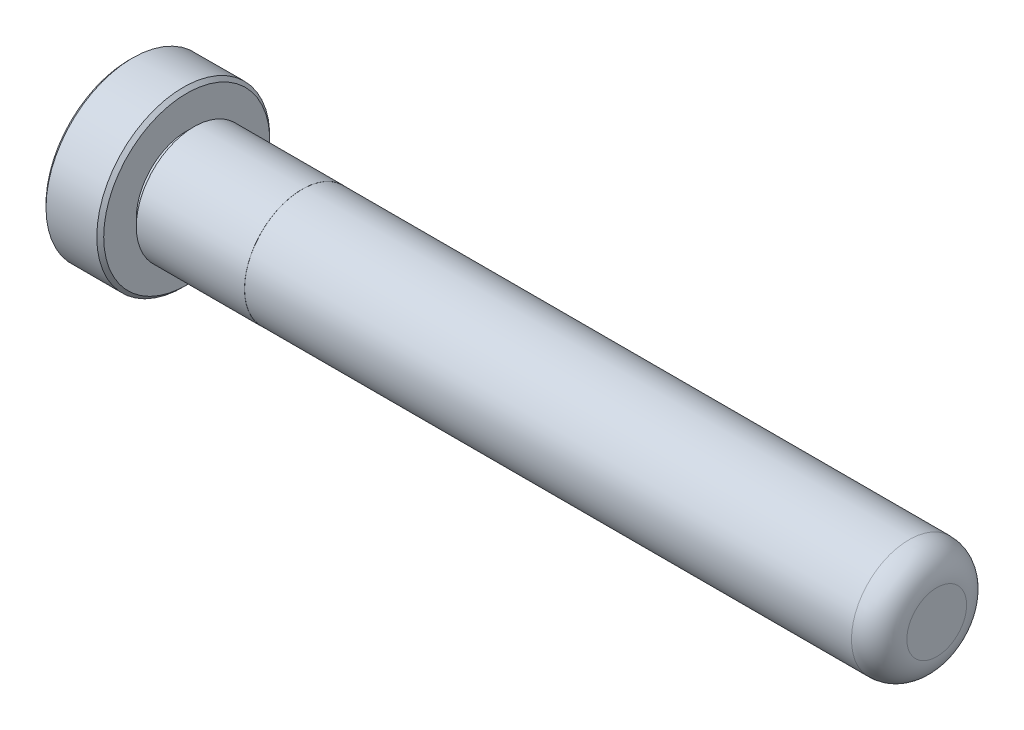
SolidWorks part; units mm, degrees
ref_plane "Front Plane" through (0, 0, 0) normal (0, 0, 1) x (1, 0, 0)
ref_plane "Top Plane" through (0, 0, 0) normal (0, 1, 0) x (1, 0, 0)
ref_plane "Right Plane" through (0, 0, 0) normal (1, 0, 0) x (0, 0, -1)
sketch "Sketch1" plane through (0, 0, 0) normal (0, 0, 1) x (1, 0, 0)
  line L0 (-40.4016, 0) -> (30.0555, 0) construction
  line L1 (0, 0) -> (0, 9.525)
  line L2 (0, 9.525) -> (6.35, 9.525)
  line L3 (6.35, 9.525) -> (6.35, 5.5563)
  line L4 (7.1438, 6.35) -> (19.05, 6.35)
  line L5 (19.05, 6.35) -> (19.05, 6.3373)
  line L6 (19.05, 6.3373) -> (88.9, 6.3373)
  line L7 (88.9, 6.3373) -> (88.9, 0)
  line L8 (88.9, 0) -> (0, 0)
  line L9 (7.1438, 6.35) -> (7.1438, 5.5563)
  line L10 (7.1438, 5.5563) -> (6.35, 5.5563)
  dimension "D1" = 19.05
  dimension "D2" = 12.7
  dimension "D3" = 12.6746
  dimension "D4" = 6.35
  dimension "D5" = 19.05
  dimension "D7" = 88.9
  dimension "D8" = 0.7937
  dimension "D9" = 0.7937
revolve "Revolve1" add sketch "Sketch1" angle 360 about L0
fillet "Fillet1" radius 3.048 1 edges at (88.9, 0, 6.3373)
chamfer "Chamfer1" distance 0.381 angle 45 2 edges at (6.35, 0, 9.525) (0, 0, 9.525)
